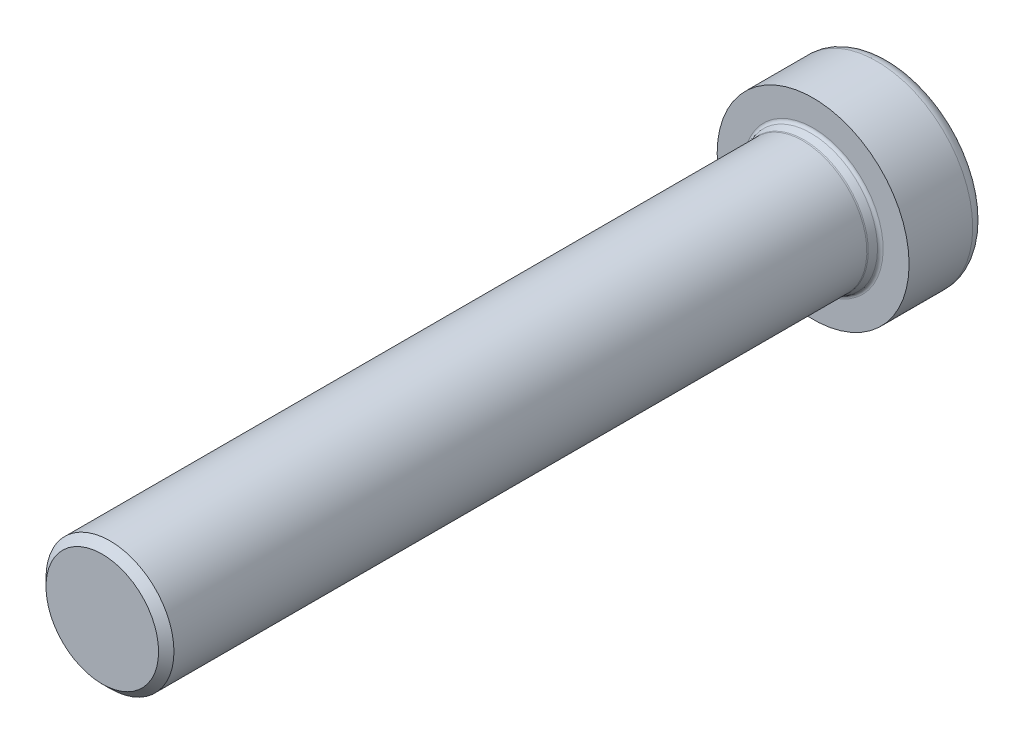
SolidWorks part; units mm, degrees
ref_plane "Ebene vorne" through (0, 0, 0) normal (0, 0, 1) x (1, 0, 0)
ref_plane "Ebene oben" through (0, 0, 0) normal (0, 1, 0) x (1, 0, 0)
ref_plane "Ebene rechts" through (0, 0, 0) normal (1, 0, 0) x (0, 0, -1)
sketch "Skizze1" plane through (0, 0, 0) normal (0, 0, 1) x (1, 0, 0)
  circle A0 centre (0, 0) radius 27
  dimension "Kopfdurchmesser" = 54
extrude "Aufsatz-Linear austragen1" add sketch "Skizze1" against normal blind 21.5 contours A0
fillet "Verrundung1" radius 3.6 1 edges at (27, 0, -21.5)
sketch "Skizze2" plane through (0, 0, 0) normal (0, 0, 1) x (1, 0, 0)
  circle A0 centre (0, 0) radius 18
  dimension "Gewindedurchmesser" = 36
extrude "Aufsatz-Linear austragen2" add sketch "Skizze2" along normal blind 200
sketch "Skizze6" plane through (0, 0, 0) normal (1, 0, 0) x (0, 0, -1)
  line L0 (0, 0) -> (-2.89, 0) construction
  line L3 (-2.5427, 18.0623) -> (-0.6527, 18.7623)
  line L4 (0, 27) -> (0, -27) construction
  line L5 (0, 19.7) -> (0, 18)
  line L6 (0, 18) -> (-2.89, 18)
  line L7 (0, 19.7) -> (0, 18)
  arc A0 (-0.6527, 18.7623) -> (0, 19.7) centre (-1, 19.7) ccw
  arc A1 (-2.5427, 18.0623) -> (-2.89, 18) centre (-2.89, 19) cw
  dimension "D1" = 1
  dimension "D2" = 39.4
  dimension "D3" = 2.89
revolve "Rotation1" add sketch "Skizze6" angle 360 about L0
sketch "Skizze4" plane through (0, 0, 200) normal (0, 0, 1) x (1, 0, 0)
  circle A0 centre (0, 0) radius 15.835
  dimension "Kerndurchmesser" = 31.67
extrude "Schnitt-Linear austragen1" cut sketch "Skizze4" against normal through all draft 45 flip side to cut contours A0
sketch "Skizze3" plane through (0, 0, 0) normal (1, 0, 0) x (0, 0, -1)
  line L8 (21.5, 0) -> (-7.6962, 0) construction
  line L9 (21.5, -23.4) -> (21.5, 23.4) construction
  line L10 (-7.6962, 0) -> (-2.5, 9)
  line L11 (-2.5, 9) -> (7.4019, 9)
  line L12 (7.4019, 9) -> (10, 13.5)
  line L13 (10, 13.5) -> (21.5, 13.5)
  line L14 (21.5, 13.5) -> (21.5, 0)
  line L15 (21.5, 0) -> (-7.6962, 0)
revolve "Schnitt-Rotation1" cut sketch "Skizze3" angle 360 about L8
sketch "Skizze5" plane through (0, 0, -21.5) normal (0, 0, -1) x (-1, 0, 0)
  line L1 (15.5019, 0.15) -> (7.8808, 13.35)
  line L2 (7.621, 13.5) -> (-7.621, 13.5)
  line L3 (-7.8808, 13.35) -> (-15.5019, 0.15)
  line L4 (-15.5019, -0.15) -> (-7.8808, -13.35)
  line L5 (-7.621, -13.5) -> (7.621, -13.5)
  line L6 (7.8808, -13.35) -> (15.5019, -0.15)
  circle A0 centre (0, 0) radius 13.5 construction
  circle A1 centre (0, 0) radius 13.5 construction
  arc A2 (15.5019, 0.15) -> (15.5019, -0.15) centre (15.242, 0) cw
  arc A3 (7.621, -13.5) -> (7.8808, -13.35) centre (7.621, -13.2) ccw
  arc A4 (-7.8808, -13.35) -> (-7.621, -13.5) centre (-7.621, -13.2) ccw
  arc A5 (-15.5019, 0.15) -> (-15.5019, -0.15) centre (-15.242, 0) ccw
  arc A6 (-7.621, 13.5) -> (-7.8808, 13.35) centre (-7.621, 13.2) ccw
  arc A7 (7.8808, 13.35) -> (7.621, 13.5) centre (7.621, 13.2) ccw
  dimension "D1" = 0.3
extrude "Schnitt-Linear austragen2" cut sketch "Skizze5" against normal blind 24 contours L2 A6 L3 A5 L4 A4 L5 A3 L6 A2 L1 A7
equation "\"D1@Schnitt-Linear austragen2\"=\"Bohrungstiefe@Skizze3\""
